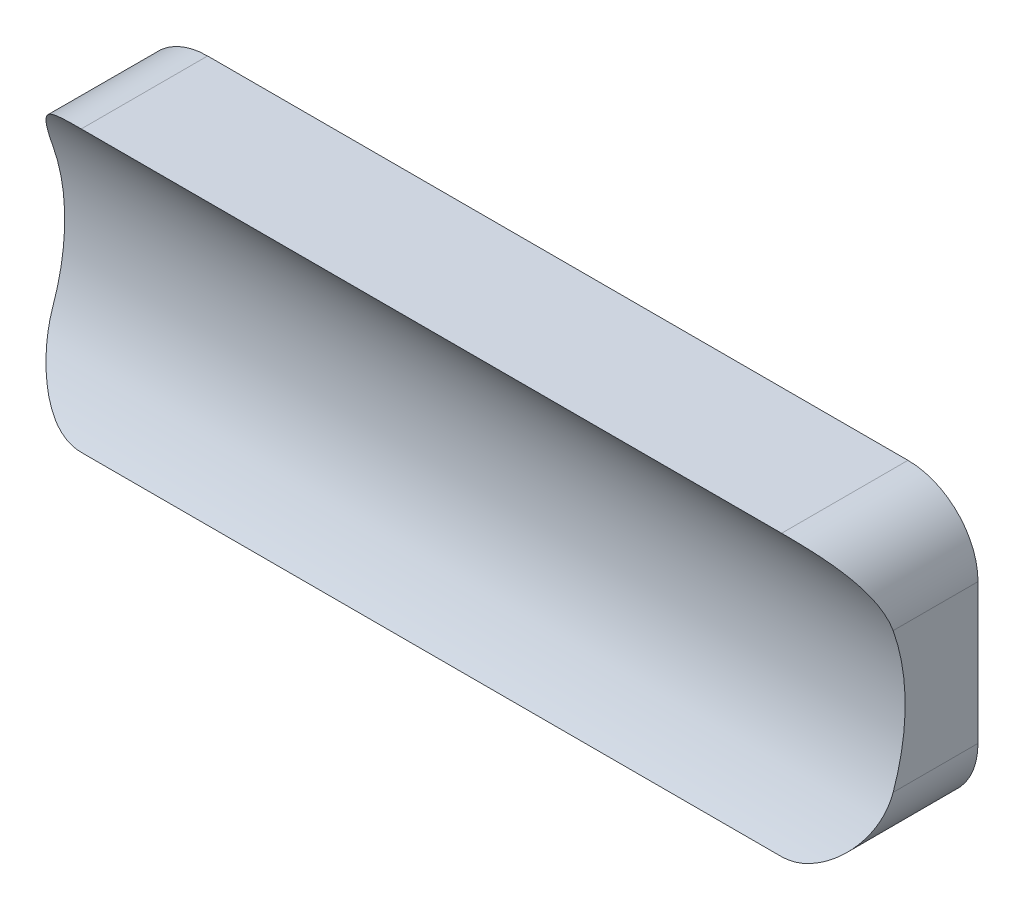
SolidWorks part; units mm, degrees
ref_plane "Front Plane" through (0, 0, 0) normal (0, 0, 1) x (1, 0, 0)
ref_plane "Top Plane" through (0, 0, 0) normal (0, 1, 0) x (1, 0, 0)
ref_plane "Right Plane" through (0, 0, 0) normal (1, 0, 0) x (0, 0, -1)
sketch "Sketch1" plane through (0, 0, 0) normal (1, 0, 0) x (0, 0, -1)
  line L3 (-8.255, 6.35) -> (0, 6.35)
  line L4 (-8.255, 6.35) -> (-8.255, -6.35)
  line L5 (-8.255, -6.35) -> (0, -6.35)
  line L6 (0, 6.35) -> (0, -6.35)
  dimension "D1" = 8.255
  dimension "D2" = 12.7
extrude "Extrude1" add sketch "Sketch1" along normal mid plane 38.1
sketch "Sketch2" plane through (-19.05, 0, 0) normal (-1, 0, 0) x (0, 0, 1)
  circle A0 centre (12.827, 0) radius 9.525
  dimension "D1" = 12.827
extrude "Cut-Extrude1" cut sketch "Sketch2" against normal up to surface (38.1 mm away)
fillet "Fillet1" radius 3.175 4 edges at (-19.05, -6.35, 2.8637) (-19.05, 6.35, 2.8637) (19.05, -6.35, 2.8637) (19.05, 6.35, 2.8637)
